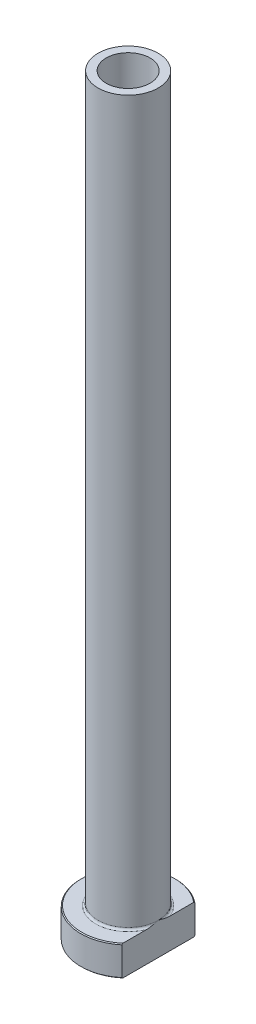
SolidWorks part; units mm, degrees
ref_plane "Front Plane" through (0, 0, 0) normal (0, 0, 1) x (1, 0, 0)
ref_plane "Top Plane" through (0, 0, 0) normal (0, 1, 0) x (1, 0, 0)
ref_plane "Right Plane" through (0, 0, 0) normal (1, 0, 0) x (0, 0, -1)
sketch "Sketch1" plane through (0, 0, 0) normal (0, 0, 1) x (1, 0, 0)
  line L0 (-5.1, 175) -> (-7, 175)
  line L1 (-7, 175) -> (-7, 7)
  line L2 (-7, 7) -> (-11, 7)
  line L3 (-11, 7) -> (-11, 0)
  line L4 (9.9, 0) -> (-9.9, 0) construction
  line L5 (-11, 0) -> (-5.35, 0)
  line L6 (-5.1, 120) -> (-5.1, 175)
  line L7 (0, 92.1877) -> (0, -15.5353) construction
  line L8 (0, -12.1) -> (0, 12.1) construction
  line L9 (-5.1, 120) -> (-5.35, 108)
  line L10 (-5.35, 108) -> (-5.35, 0)
  dimension "D1" = 0.25
  dimension "ID" = 10.2
  dimension "OD" = 14
  dimension "L" = 175
  dimension "H" = 22
  dimension "T" = 7
  dimension "N" = 55
  dimension "D2" = 12
  dimension "L-N" = 120
revolve "Revolve1" add sketch "Sketch1" angle 360 about L7
fillet "Fillet1" radius 0.5 1 edges at (0, 7, 7)
chamfer "Chamfer1" distance 0.2 angle 45 2 edges at (0, 7, 11) (0, 0, 11)
sketch "Sketch2" plane through (0, 0, 0) normal (0, -1, 0) x (1, 0, 0)
  line L0 (7, 8.4853) -> (7, -8.4853)
  circle A0 centre (0, 0) radius 11 construction
  arc A1 (7, 8.4853) -> (7, -8.4853) centre (0, 0) cw
  circle A2 centre (0, 0) radius 7 construction
extrude "Cut-Extrude1" cut sketch "Sketch2" against normal through all
chamfer "Chamfer2" distance 0.5 angle 45 1 edges at (0, 0, 5.35)
